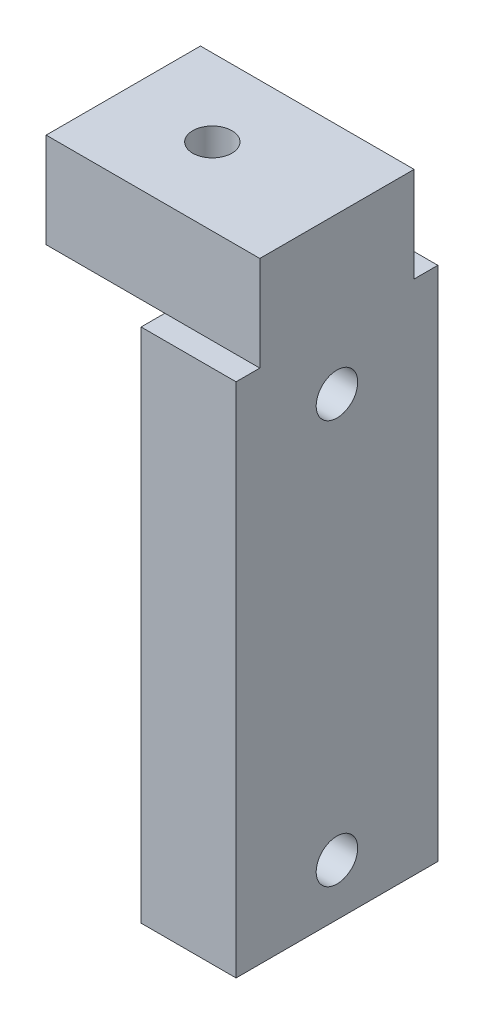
SolidWorks part; units mm, degrees
ref_plane "前视基准面" through (0, 0, 0) normal (0, 0, 1) x (1, 0, 0)
ref_plane "上视基准面" through (0, 0, 0) normal (0, 1, 0) x (1, 0, 0)
ref_plane "右视基准面" through (0, 0, 0) normal (1, 0, 0) x (0, 0, -1)
sketch "草图1" plane through (0, 0, 0) normal (0, 0, 1) x (1, 0, 0)
  line L0 (0, 43.5) -> (10, 43.5)
  line L1 (10, 0) -> (18, 0)
  line L2 (0, 51.5) -> (18, 51.5)
  line L3 (0, 43.5) -> (0, 51.5)
  line L4 (10, 0) -> (10, 43.5)
  line L5 (18, 0) -> (18, 51.5)
extrude "凸台-拉伸1" add sketch "草图1" along normal blind 17
sketch "草图2" plane through (18, 0, 0) normal (1, 0, 0) x (0, 0, -1)
  line L0 (-15, 43.5) -> (-17, 43.5)
  line L1 (-2, 51.5) -> (-15, 51.5)
  line L2 (0, 0) -> (-17, 0)
  line L3 (-17, 0) -> (-17, 43.5)
  line L4 (0, 0) -> (0, 43.5)
  line L5 (-15, 43.5) -> (-15, 51.5)
  line L6 (-2, 43.5) -> (-2, 51.5)
  line L7 (0, 43.5) -> (-2, 43.5)
  circle A0 centre (-8.5, 4.3583) radius 1.75
  circle A1 centre (-8.5, 38.3583) radius 1.75
extrude "切除-拉伸1" cut sketch "草图2" against normal through all flip side to cut
sketch "草图3" plane through (0, 51.5, 0) normal (0, 1, 0) x (1, 0, 0)
  line L0 (10, -2) -> (10, 0)
  line L1 (0, -2) -> (10, -2)
  line L2 (0, -15) -> (10, -15)
  line L3 (10, -17) -> (18, -17)
  line L4 (10, 0) -> (18, 0)
  line L5 (18, -17) -> (18, 0)
  line L6 (0, -15) -> (0, -2)
  line L7 (10, -17) -> (10, -15)
  circle A0 centre (7.5, -8.5) radius 1.65
extrude "切除-拉伸2" cut sketch "草图3" against normal through all flip side to cut
